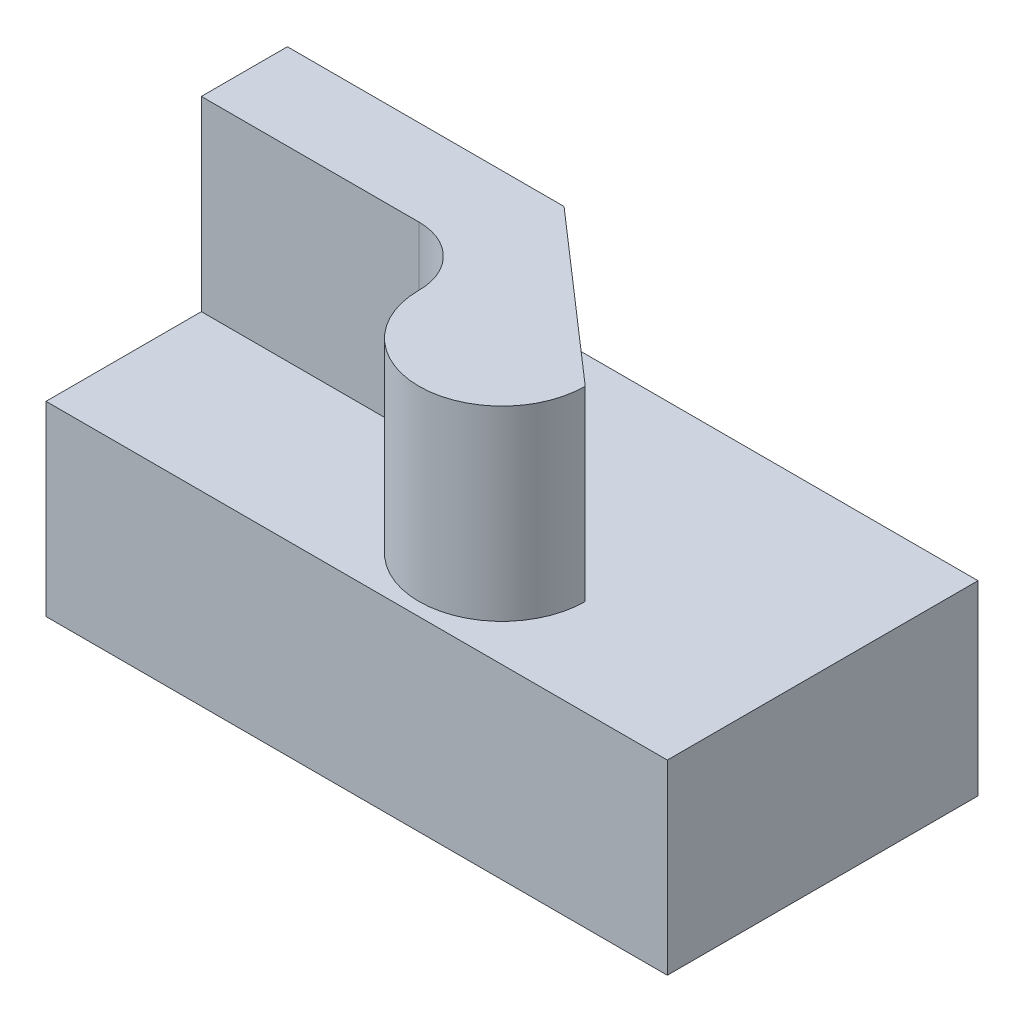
SolidWorks part; units mm, degrees
ref_plane "Front Plane" through (0, 0, 0) normal (0, 0, 1) x (1, 0, 0)
ref_plane "Top Plane" through (0, 0, 0) normal (0, 1, 0) x (1, 0, 0)
ref_plane "Right Plane" through (0, 0, 0) normal (1, 0, 0) x (0, 0, -1)
sketch "Sketch1" plane through (0, 0, 0) normal (0, 1, 0) x (1, 0, 0)
  line L1 (0, 0) -> (100, 0)
  line L2 (0, 0) -> (0, 50)
  line L3 (0, 50) -> (100, 50)
  line L4 (100, 0) -> (100, 50)
  dimension "D1" = 100
  dimension "D2" = 50
extrude "Extrude1" add sketch "Sketch1" along normal blind 30
ref_plane "Plane1" through (9.3103, 31.0345, -18.6207) normal (-0.2491, -0.8305, 0.4983) x (0.9685, -0.2136, 0.1282)
ref_plane "Plane2" through (0, -10, -10) normal (0, -0.7071, -0.7071) x (1, 0, 0)
sketch "Sketch2" plane through (0, 30, 0) normal (0, 1, 0) x (-1, 0, 0)
  line L0 (0, -25) -> (-35.0201, -25)
  line L1 (0, -50) -> (0, 0) construction
  line L2 (-71.2946, -15.4906) -> (-44.5295, -38.8487)
  line L3 (-44.5295, -38.8487) -> (0, -38.8487)
  line L4 (0, -38.8487) -> (0, -25)
  arc A0 (-35.0201, -25) -> (-44.5295, -15.4906) centre (-35.0201, -15.4906) cw
  arc A1 (-44.5295, -15.4906) -> (-71.2946, -15.4906) centre (-57.9121, -15.4906) ccw
ref_plane "Plane3" through (71.2946, 30, -15.4906) normal (0, 0, -1) x (-1, 0, 0)
extrude "Extrude2" add sketch "Sketch2" along normal blind 30
ref_plane "Plane4" through (71.2946, 60, -15.4906) normal (0, 0, -1) x (-1, 0, 0)
